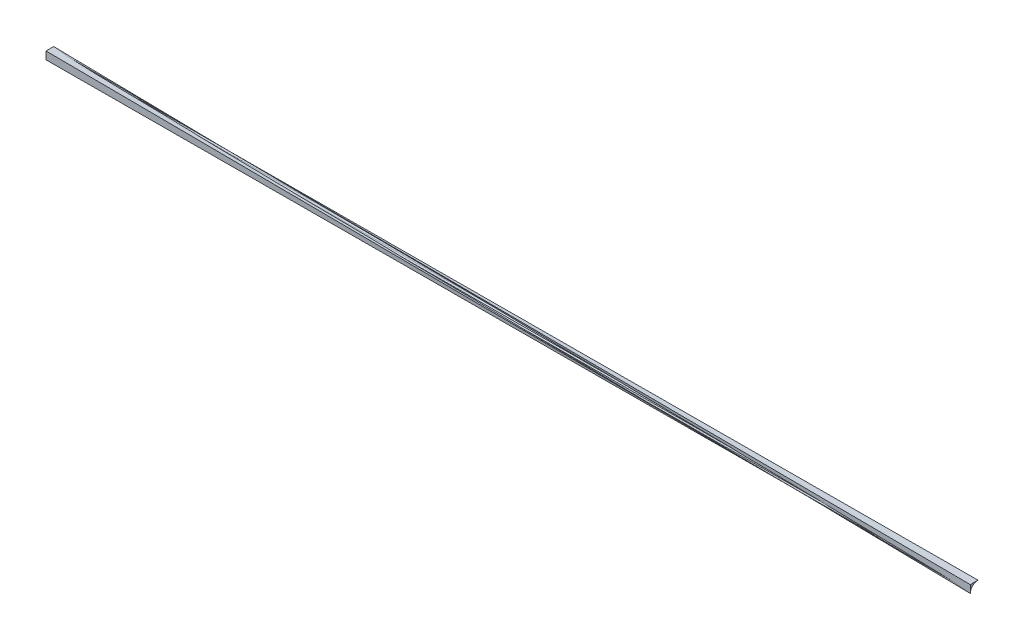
SolidWorks part; units mm, degrees
ref_plane "Front Plane" through (0, 0, 0) normal (1, 0, 0) x (0, 1, 0)
ref_plane "Top Plane" through (0, 0, 0) normal (0, 0, 1) x (0, 1, 0)
ref_plane "Right Plane" through (0, 0, 0) normal (0, 1, 0) x (-1, 0, 0)
sketch "Sketch1" plane through (0, 0, 0) normal (1, 0, 0) x (0, 1, 0)
  line L0 (152.4, 152.4) -> (149.225, 152.4)
  line L1 (149.225, 152.4) -> (149.8444, 152.339)
  line L2 (149.8444, 152.339) -> (150.44, 152.1583)
  line L3 (150.44, 152.1583) -> (150.9889, 151.8649)
  line L4 (150.9889, 151.8649) -> (151.4701, 151.4701)
  line L5 (151.4701, 151.4701) -> (151.8649, 150.9889)
  line L6 (151.8649, 150.9889) -> (152.1583, 150.44)
  line L7 (152.1583, 150.44) -> (152.339, 149.8444)
  line L8 (152.339, 149.8444) -> (152.4, 149.225)
  line L9 (152.4, 149.225) -> (152.4, 152.4)
ref_plane "Plane1" through (304.8, 0, 0) normal (1, 0, 0) x (0, 1, 0)
sketch "Sketch2" plane through (304.8, 0, 0) normal (1, 0, 0) x (0, 1, 0)
  line L0 (76.2, 76.2) -> (73.025, 76.2)
  line L1 (73.025, 76.2) -> (73.6444, 76.139)
  line L2 (73.6444, 76.139) -> (74.24, 75.9583)
  line L3 (74.24, 75.9583) -> (74.7889, 75.6649)
  line L4 (74.7889, 75.6649) -> (75.2701, 75.2701)
  line L5 (75.2701, 75.2701) -> (75.6649, 74.7889)
  line L6 (75.6649, 74.7889) -> (75.9583, 74.24)
  line L7 (75.9583, 74.24) -> (76.139, 73.6444)
  line L8 (76.139, 73.6444) -> (76.2, 73.025)
  line L9 (76.2, 73.025) -> (76.2, 76.2)
loft "Applied_tapered_corner_caulk" add profiles "Sketch1", "Sketch2"
